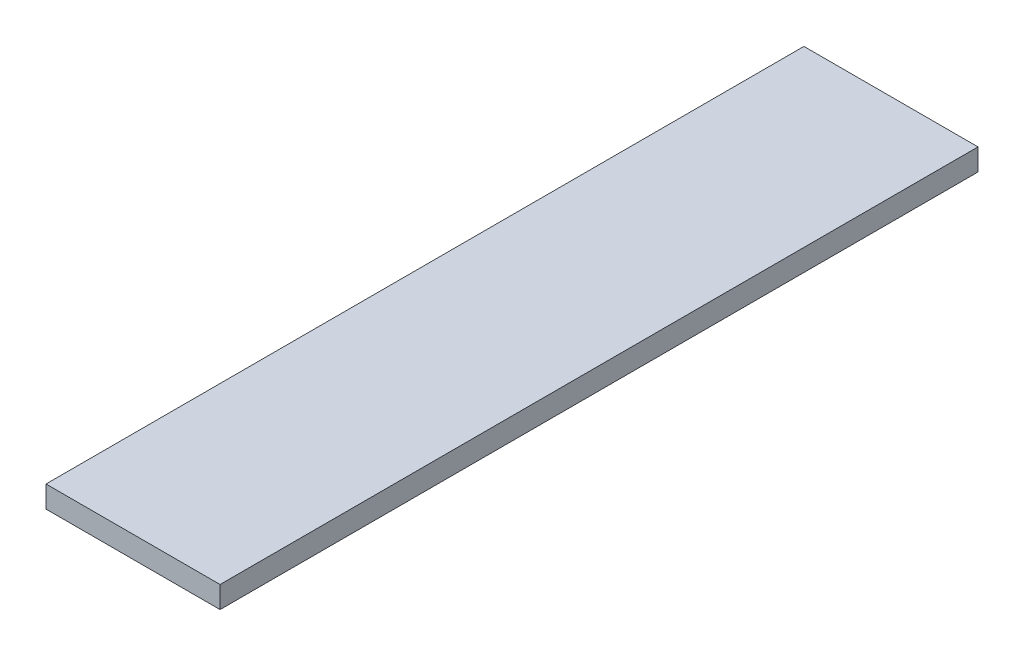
SolidWorks part; units mm, degrees
ref_plane "Front Plane" through (0, 0, 0) normal (0, 0, 1) x (1, 0, 0)
ref_plane "Top Plane" through (0, 0, 0) normal (0, 1, 0) x (1, 0, 0)
ref_plane "Right Plane" through (0, 0, 0) normal (1, 0, 0) x (0, 0, -1)
sketch "Sketch1" plane through (0, 0, 0) normal (0, 1, 0) x (1, 0, 0)
  line L1 (-38.1, 165.8938) -> (38.1, 165.8938)
  line L2 (-38.1, 165.8938) -> (-38.1, -165.8937)
  line L3 (-38.1, -165.8937) -> (38.1, -165.8937)
  line L4 (38.1, 165.8938) -> (38.1, -165.8937)
  line L5 (-38.1, 165.8938) -> (38.1, -165.8937) construction
  line L6 (-38.1, -165.8937) -> (38.1, 165.8938) construction
  point P0 (0, 0)
  dimension "D1" = 331.7875
  dimension "D2" = 76.2
extrude "Boss-Extrude1" add sketch "Sketch1" along normal blind 9.525
